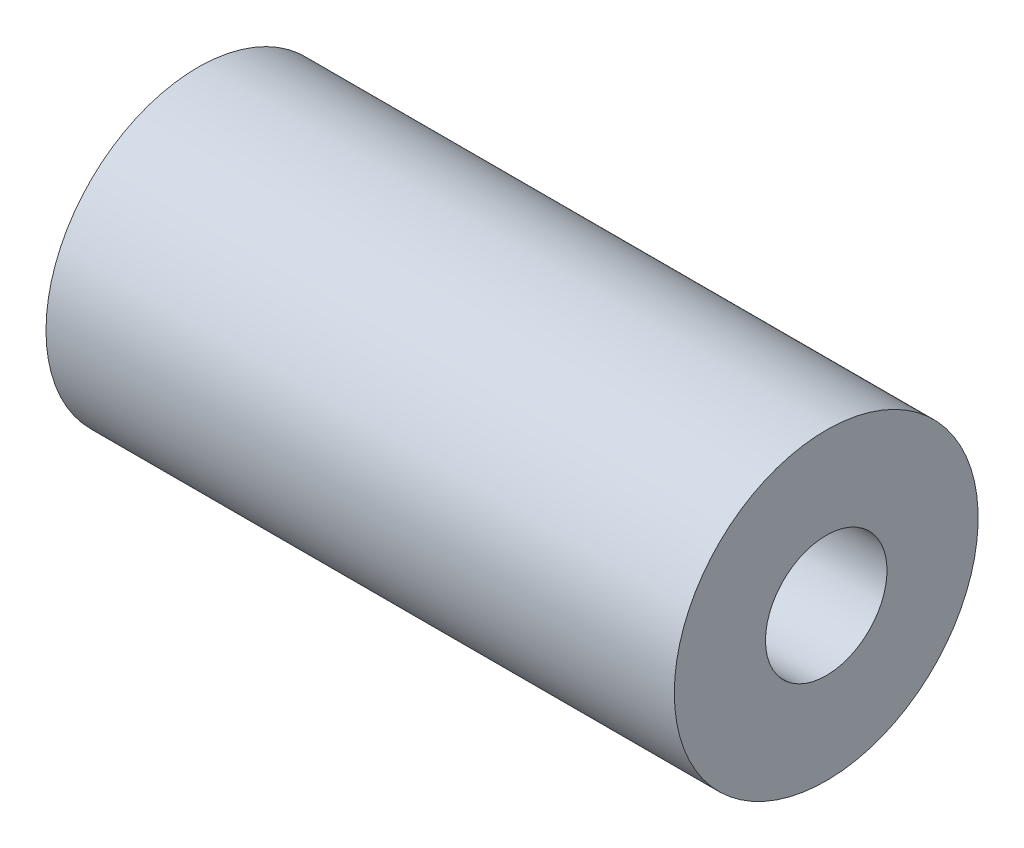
SolidWorks part; units mm, degrees
ref_plane "Piano frontale" through (0, 0, 0) normal (0, 0, 1) x (1, 0, 0)
ref_plane "Piano superiore" through (0, 0, 0) normal (0, 1, 0) x (1, 0, 0)
ref_plane "Piano destro" through (0, 0, 0) normal (1, 0, 0) x (0, 0, -1)
sketch "Schizzo1" plane through (0, 0, 0) normal (0, 0, 1) x (1, 0, 0)
  line L0 (-25.572, 0) -> (33.9161, 0) construction
  line L1 (-18.3802, 5) -> (-18.3802, 12.5)
  line L2 (-18.3802, 12.5) -> (33.3198, 12.5)
  line L3 (33.3198, 12.5) -> (33.3198, 5)
  line L4 (33.3198, 5) -> (-18.3802, 5)
  dimension "D1" = 12.5
  dimension "D2" = 51.7
  dimension "D3" = 5
revolve "Rivoluzione1" add sketch "Schizzo1" angle 360 about L0
